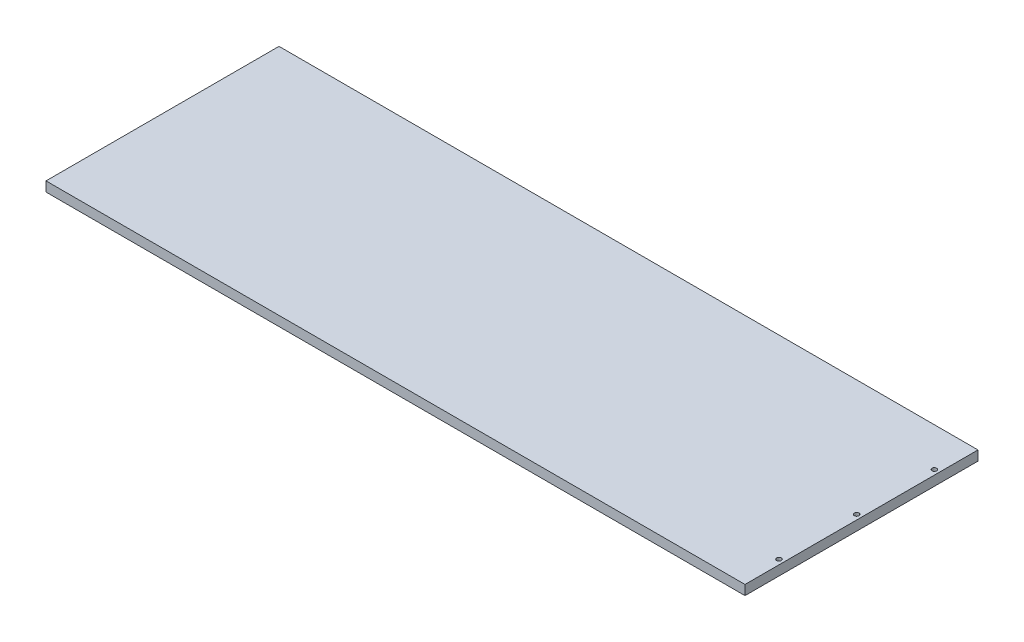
SolidWorks part; units mm, degrees
ref_plane "Front Plane" through (0, 0, 0) normal (0, 0, 1) x (1, 0, 0)
ref_plane "Top Plane" through (0, 0, 0) normal (0, 1, 0) x (1, 0, 0)
ref_plane "Right Plane" through (0, 0, 0) normal (1, 0, 0) x (0, 0, -1)
sketch "Sketch1" plane through (0, 0, 0) normal (0, 1, 0) x (1, 0, 0)
  line L1 (-228.6, -76.2) -> (228.6, -76.2)
  line L2 (-228.6, -76.2) -> (-228.6, 76.2)
  line L3 (-228.6, 76.2) -> (228.6, 76.2)
  line L4 (228.6, -76.2) -> (228.6, 76.2)
  line L5 (-228.6, -76.2) -> (228.6, 76.2) construction
  line L6 (-228.6, 76.2) -> (228.6, -76.2) construction
  point P0 (0, 0)
extrude "Boss-Extrude1" add sketch "Sketch1" along normal blind 6.35
hole_wizard "#4-40 Tapped Hole1" positions "Sketch2" profile "Sketch3" tap size "#4-40" standard "ANSI Inch"
sketch "Sketch2" plane through (-228.6, 0, 0) normal (-1, 0, 0) x (0, 0, 1)
  line L0 (-76.2, 6.35) -> (-76.2, 0) construction
  line L1 (-76.2, 0) -> (76.2, 0) construction
  point P0 (0, 3.175)
  point P2 (50.8, 3.175)
  point P4 (-50.8, 3.175)
  dimension "D1" = 76.2
  dimension "D2" = 50.8
  dimension "D3" = 50.8
  dimension "D4" = 3.175
sketch "Sketch3" plane through (-228.6, 3.175, 0) normal (0, 1, 0) x (0, 0, 1)
  line L0 (0, 0) -> (0, 8.2992)
  line L1 (0, 8.2992) -> (1.1303, 7.62)
  line L2 (1.1303, 7.62) -> (1.1303, 0)
  line L5 (1.1303, 0) -> (0, 0)
  line L10 (0, 8.2992) -> (-1.1303, 7.62) construction
  line L11 (0, -6.35) -> (0, 107.95) construction
  dimension "Tap Drill Dia." = 2.2606
  dimension "Tap Drill Depth" = 7.62
  dimension "Drill Angle" = 118
hole_wizard "#31 (0.12) Diameter Hole1" positions "Sketch4" profile "Sketch6" hole size "#31" standard "ANSI Inch"
sketch "Sketch4" plane through (0, 6.35, 0) normal (0, 1, 0) x (1, 0, 0)
  line L0 (228.6, 76.2) -> (-228.6, 76.2) construction
  line L1 (228.6, -76.2) -> (228.6, 76.2) construction
  point P0 (225.425, 0)
  point P2 (225.425, 50.8)
  point P4 (225.425, -50.8)
  dimension "D1" = 76.2
  dimension "D2" = 50.8
  dimension "D3" = 50.8
  dimension "D4" = 3.175
sketch "Sketch6" plane through (225.425, 6.35, 0) normal (1, 0, 0) x (0, 0, 1)
  line L0 (0, 0) -> (0, 6.35)
  line L1 (0, 6.35) -> (1.524, 6.35)
  line L2 (1.524, 6.35) -> (1.524, 0)
  line L5 (1.524, 0) -> (0, 0)
  line L11 (0, -6.35) -> (0, 107.95) construction
  dimension "Thru Hole Dia." = 3.048
  dimension "Thru Hole Depth" = 6.35
